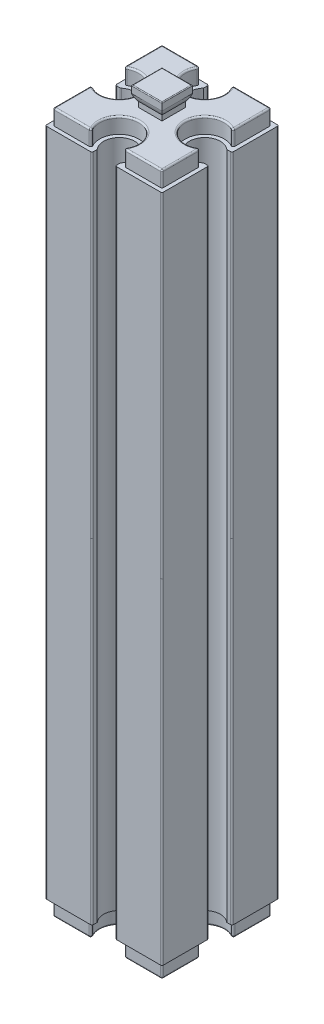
SolidWorks part; units mm, degrees
ref_plane "前视基准面" through (0, 0, 0) normal (0, 0, 1) x (1, 0, 0)
ref_plane "上视基准面" through (0, 0, 0) normal (0, 1, 0) x (1, 0, 0)
ref_plane "右视基准面" through (0, 0, 0) normal (1, 0, 0) x (0, 0, -1)
sketch "草图1" plane through (0, 0, 0) normal (0, 1, 0) x (1, 0, 0)
  line L0 (0, 0) -> (0, 7.5) construction
  line L1 (0, 0) -> (7.5, 0) construction
  line L2 (-7.5, 7.5) -> (-1.5, 7.5)
  line L3 (7.5, 7.5) -> (7.5, 1.5)
  line L4 (6.8229, 1.5) -> (7.5, 1.5)
  line L5 (6.8229, -1.5) -> (7.5, -1.5)
  line L6 (0, 7.5) -> (0, 5.5) construction
  line L7 (-1.5, 6.8229) -> (-1.5, 7.5)
  line L8 (1.5, 6.8229) -> (1.5, 7.5)
  line L9 (1.5, 7.5) -> (7.5, 7.5)
  line L10 (7.5, -1.5) -> (7.5, -7.5)
  line L11 (7.5, -7.5) -> (1.5, -7.5)
  line L12 (1.5, -6.8229) -> (1.5, -7.5)
  line L13 (-1.5, -6.8229) -> (-1.5, -7.5)
  line L14 (-1.5, -7.5) -> (-7.5, -7.5)
  line L15 (-7.5, -7.5) -> (-7.5, -1.5)
  line L16 (-6.8229, -1.5) -> (-7.5, -1.5)
  line L17 (-6.8229, 1.5) -> (-7.5, 1.5)
  line L18 (-7.5, 1.5) -> (-7.5, 7.5)
  arc A0 (-1.5, 6.8229) -> (1.5, 6.8229) centre (0, 5.5) ccw
  arc A1 (6.8229, 1.5) -> (6.8229, -1.5) centre (5.5, 0) ccw
  arc A2 (1.5, -6.8229) -> (-1.5, -6.8229) centre (0, -5.5) ccw
  arc A3 (-6.8229, -1.5) -> (-6.8229, 1.5) centre (-5.5, 0) ccw
  point P36 (0, 0)
  dimension "D6" = 4
  dimension "D7" = 2
  dimension "D1" = 7.5
  dimension "D2" = 7.5
  dimension "D3" = 2
  dimension "D4" = 7.5
  dimension "D5" = 1.5
extrude "凸台-拉伸1" add sketch "草图1" along normal blind 43
sketch "草图2" plane through (0, 43, 0) normal (0, 1, 0) x (1, 0, 0)
  line L0 (-7, 7) -> (-7, 2)
  line L1 (-7, 2) -> (-7, 2)
  line L2 (-7, -2) -> (-7, -2)
  line L3 (-7, -2) -> (-7, -7)
  line L4 (-7, -7) -> (-2, -7)
  line L5 (-2, -7) -> (-2, -7)
  line L6 (2, -7) -> (2, -7)
  line L7 (2, -7) -> (7, -7)
  line L8 (7, -7) -> (7, -2)
  line L9 (7, -2) -> (7, -2)
  line L10 (7, 2) -> (7, 2)
  line L11 (7, 2) -> (7, 7)
  line L12 (7, 7) -> (2, 7)
  line L13 (2, 7) -> (2, 7)
  line L14 (-2, 7) -> (-2, 7)
  line L15 (-2, 7) -> (-7, 7)
  line L16 (-7.5, 7.5) -> (-7.5, 1.5)
  line L17 (-7.5, 1.5) -> (-6.8229, 1.5)
  line L18 (-6.8229, -1.5) -> (-7.5, -1.5)
  line L19 (-7.5, -1.5) -> (-7.5, -7.5)
  line L20 (-7.5, -7.5) -> (-1.5, -7.5)
  line L21 (-1.5, -7.5) -> (-1.5, -6.8229)
  line L22 (1.5, -6.8229) -> (1.5, -7.5)
  line L23 (1.5, -7.5) -> (7.5, -7.5)
  line L24 (7.5, -7.5) -> (7.5, -1.5)
  line L25 (7.5, -1.5) -> (6.8229, -1.5)
  line L26 (6.8229, 1.5) -> (7.5, 1.5)
  line L27 (7.5, 1.5) -> (7.5, 7.5)
  line L28 (7.5, 7.5) -> (1.5, 7.5)
  line L29 (1.5, 7.5) -> (1.5, 6.8229)
  line L30 (-1.5, 6.8229) -> (-1.5, 7.5)
  line L31 (-1.5, 7.5) -> (-7.5, 7.5)
  line L32 (-7.5, 7.5) -> (-7.5, 1.5) construction
  line L33 (-7.5, 1.5) -> (-6.8229, 1.5) construction
  line L34 (-6.8229, -1.5) -> (-7.5, -1.5) construction
  line L35 (-7.5, -1.5) -> (-7.5, -7.5) construction
  line L36 (-7.5, -7.5) -> (-1.5, -7.5) construction
  line L37 (-1.5, -7.5) -> (-1.5, -6.8229) construction
  line L38 (1.5, -6.8229) -> (1.5, -7.5) construction
  line L39 (1.5, -7.5) -> (7.5, -7.5) construction
  line L40 (7.5, -7.5) -> (7.5, -1.5) construction
  line L41 (7.5, -1.5) -> (6.8229, -1.5) construction
  line L42 (6.8229, 1.5) -> (7.5, 1.5) construction
  line L43 (7.5, 1.5) -> (7.5, 7.5) construction
  line L44 (7.5, 7.5) -> (1.5, 7.5) construction
  line L45 (1.5, 7.5) -> (1.5, 6.8229) construction
  line L46 (-1.5, 6.8229) -> (-1.5, 7.5) construction
  line L47 (-1.5, 7.5) -> (-7.5, 7.5) construction
  arc A0 (-7, -2) -> (-7, 2) centre (-5.5, 0) ccw
  arc A1 (2, -7) -> (-2, -7) centre (0, -5.5) ccw
  arc A2 (7, 2) -> (7, -2) centre (5.5, 0) ccw
  arc A3 (-2, 7) -> (2, 7) centre (0, 5.5) ccw
  arc A4 (-6.8229, -1.5) -> (-6.8229, 1.5) centre (-5.5, 0) ccw
  arc A5 (1.5, -6.8229) -> (-1.5, -6.8229) centre (0, -5.5) ccw
  arc A6 (6.8229, 1.5) -> (6.8229, -1.5) centre (5.5, 0) ccw
  arc A7 (-1.5, 6.8229) -> (1.5, 6.8229) centre (0, 5.5) ccw
  arc A8 (-6.8229, -1.5) -> (-6.8229, 1.5) centre (-5.5, 0) ccw construction
  arc A9 (1.5, -6.8229) -> (-1.5, -6.8229) centre (0, -5.5) ccw construction
  arc A10 (6.8229, 1.5) -> (6.8229, -1.5) centre (5.5, 0) ccw construction
  arc A11 (-1.5, 6.8229) -> (1.5, 6.8229) centre (0, 5.5) ccw construction
  dimension "D1" = 0
  dimension "D2" = 0.5
extrude "凸台-拉伸2" add sketch "草图2" along normal blind 2
sketch "草图3" plane through (0, 0, 0) normal (1, 0, 0) x (0, 0, -1)
  line L0 (0, 45) -> (0, 47) construction
  line L1 (2.5, 45) -> (-2.5, 45) construction
  line L2 (0, 47) -> (0, 47.5) construction
  line L3 (-1.5, 45) -> (1.5, 45)
  line L4 (1.5, 45) -> (1.5, 45.6771)
  line L5 (-1.95, 47.5) -> (1.95, 47.5)
  line L6 (1.95, 47.5) -> (1.95, 46.5556)
  line L7 (-1.5, 45) -> (-1.5, 45.6771)
  line L8 (-1.95, 47.5) -> (-1.95, 46.5556)
  arc A0 (-1.5, 45.6771) -> (-1.95, 46.5556) centre (0, 47) cw
  arc A1 (1.5, 45.6771) -> (1.95, 46.5556) centre (0, 47) ccw
  dimension "D5" = 2
  dimension "D1" = 2
  dimension "D2" = 0.5
  dimension "D3" = 1.5
  dimension "D4" = 1.95
extrude "凸台-拉伸3" add sketch "草图3" along normal blind 2 and the other way blind 2
sketch "草图4" plane through (0, 0, 0) normal (0, 0, 1) x (1, 0, 0)
  line L0 (0, 45) -> (0, 47) construction
  line L2 (-2, 45) -> (2, 45) construction
  line L3 (0, 47) -> (0, 47.5) construction
  line L4 (-2, 47.5) -> (2, 47.5) construction
  line L5 (1.95, 47.5) -> (2, 47.5)
  line L6 (-1.95, 47.5) -> (-1.95, 46.5556)
  line L9 (-1.5, 45) -> (-1.5, 45.6771)
  line L10 (1.5, 45) -> (1.5, 45.6771)
  line L11 (1.95, 47.5) -> (1.95, 46.5556)
  line L12 (1.5, 45) -> (2, 45)
  line L13 (-2, 47.5) -> (-1.95, 47.5)
  line L14 (-2, 47.5) -> (-2, 45)
  line L15 (-2, 45) -> (-1.5, 45)
  line L16 (2, 47.5) -> (2, 45)
  arc A0 (-1.95, 46.5556) -> (-1.5, 45.6771) centre (0, 47) ccw
  arc A1 (1.95, 46.5556) -> (1.5, 45.6771) centre (0, 47) cw
  dimension "D1" = 2
  dimension "D2" = 1.5
  dimension "D3" = 1.95
fillet "圆角3" radius 0.2 13 edges at (-1.5, 21.5, -7.5) (1.5, 21.5, -7.5) (7.5, 21.5, -7.5) (7.5, 21.5, -1.5) (7.5, 21.5, 1.5) (7.5, 21.5, 7.5) (-1.5, 21.5, 7.5) (1.5, 21.5, 7.5) (-6.8229, 21.5, -1.5) (-7.5, 21.5, 7.5) (-7.5, 21.5, 1.5) (-7.5, 21.5, -1.5) (-7.5, 21.5, -7.5)
extrude "切除-拉伸1" cut sketch "草图4" against normal blind 3 and the other way blind 3
fillet "圆角4" radius 0.2 24 edges at (0, 45, 3) (-3, 45, 0) (0, 45, -3) (3, 45, 0) (7, 44, 2) (7, 44, -2) (2, 44, -7) (-2, 44, -7) (-7, 44, 2) (-7, 44, -2) (2, 44, 7) (-2, 44, 7) (7, 44, 7) (4.5, 45, 7) (7, 45, 4.5) (7, 45, -4.5) (7, 44, -7) (4.5, 45, -7) (-4.5, 45, -7) (-7, 44, -7) (-7, 45, -4.5) (-4.5, 45, 7) (-7, 45, 4.5) (-7, 44, 7)
fillet "圆角5" radius 0.1 4 edges at (0, 47.5, -1.95) (1.95, 47.5, 0) (0, 47.5, 1.95) (-1.95, 47.5, 0)
mirror "镜向1" of "圆角4", "圆角5", "切除-拉伸1", "凸台-拉伸3", "圆角3", "凸台-拉伸2", "凸台-拉伸1"
